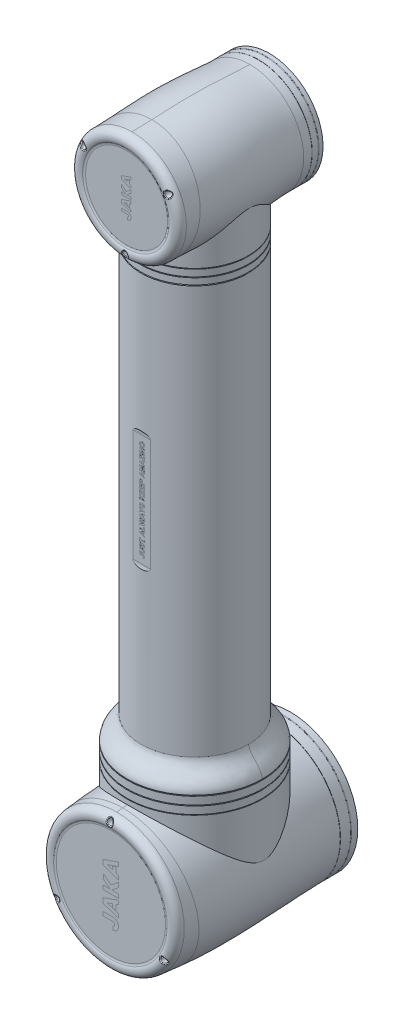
SolidWorks part; units mm, degrees
ref_plane "前视基准面" through (0, 0, 0) normal (0, 0, 1) x (1, 0, 0)
ref_plane "上视基准面" through (0, 0, 0) normal (0, 1, 0) x (1, 0, 0)
ref_plane "右视基准面" through (0, 0, 0) normal (1, 0, 0) x (0, 0, -1)
imported_body "输入1"
imported_body "输入2"
imported_body "输入3"
imported_body "输入4"
imported_body "输入5"
sketch "草图1" plane through (0, 0, 911.6797) normal (0, 0, -1) x (-1, 0, 0)
  line L0 (-107.4829, 518.564) -> (-107.4829, -300.436) construction
ref_plane "基准面1" through (107.4829, 0, 0) normal (1, 0, 0) x (0, 0, -1)
sketch "草图2" plane through (107.4829, 0, 0) normal (1, 0, 0) x (0, 0, -1)
  line L3 (-920.1797, -394.0908) -> (-920.1997, -394.0908)
  line L4 (-920.1797, -394.0908) -> (-920.1797, -393.0171)
  line L5 (-920.1797, -393.0171) -> (-920.1997, -393.0171)
  line L6 (-920.1997, -394.0908) -> (-920.1997, -393.0171)
  line L7 (-921.1797, -393.0043) -> (-921.1597, -393.0043)
  line L8 (-921.1797, -393.0043) -> (-921.1797, -394.0908)
  line L9 (-921.1797, -394.0908) -> (-921.1597, -394.0908)
  line L10 (-921.1597, -393.0043) -> (-921.1597, -394.0908)
  line L11 (-911.6797, -393.436) -> (-911.6797, -210.6049) construction
  line L12 (-911.6797, -300.436) -> (-963.494, -300.436) construction
  line L13 (-911.6797, 518.564) -> (-911.6797, -300.436) construction
  dimension "D1" = 8.5
  dimension "D2" = 0.02
  dimension "D3" = 0.02
  dimension "D4" = 1
revolve "切除-旋转1" cut sketch "草图2" angle 360 about L12
sketch "草图3" plane through (107.4829, 0, 0) normal (1, 0, 0) x (0, 0, -1)
  line L0 (-911.6797, 518.564) -> (-1000.9129, 518.564) construction
  line L1 (-911.6797, 518.564) -> (-911.6797, -300.436) construction
  line L2 (-940.5297, 592.564) -> (-955.4797, 592.564) construction
  line L3 (-946.0497, 592.564) -> (-946.0297, 592.564)
  line L4 (-946.0497, 592.564) -> (-946.0497, 591.5777)
  line L5 (-946.0497, 591.5777) -> (-946.0297, 591.5777)
  line L6 (-946.0297, 592.564) -> (-946.0297, 591.5777)
  line L7 (-940.5297, 451.4035) -> (-940.5297, 592.5641) construction
  line L8 (-947.0097, 592.564) -> (-947.0297, 592.564)
  line L9 (-947.0097, 592.564) -> (-947.0097, 591.5777)
  line L10 (-947.0097, 591.5777) -> (-947.0297, 591.5777)
  line L11 (-947.0297, 592.564) -> (-947.0297, 591.5777)
  dimension "D1" = 5.5
  dimension "D2" = 0.02
  dimension "D3" = 0.02
  dimension "D4" = 1
revolve "切除-旋转2" cut sketch "草图3" angle 360 about L0
